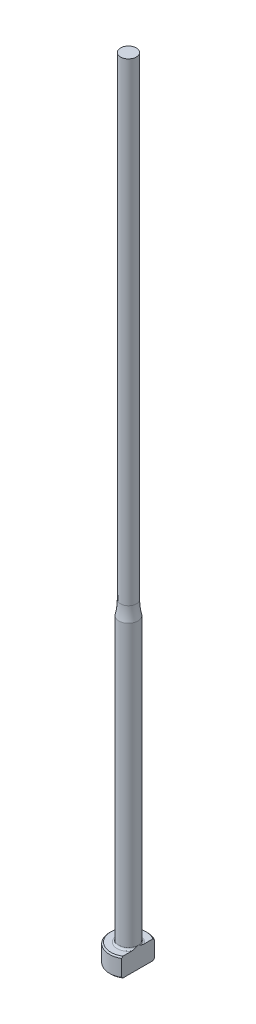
SolidWorks part; units mm, degrees
ref_plane "Front Plane" through (0, 0, 0) normal (0, 0, 1) x (1, 0, 0)
ref_plane "Top Plane" through (0, 0, 0) normal (0, 1, 0) x (1, 0, 0)
ref_plane "Right Plane" through (0, 0, 0) normal (1, 0, 0) x (0, 0, -1)
sketch "Sketch1" plane through (0, 0, 0) normal (0, 0, 1) x (1, 0, 0)
  line L0 (0, 259.9588) -> (0, -15.1925) construction
  line L1 (0, 0) -> (-3, 0)
  line L2 (-3, 0) -> (-3, 3)
  line L3 (-3, 3) -> (-1.5, 3)
  line L4 (-1.25, 50) -> (-1.25, 125)
  line L5 (-1.25, 125) -> (0, 125)
  line L6 (0, 125) -> (0, 0)
  line L7 (-1.5, 3) -> (-1.5, 47.778)
  arc A0 (-1.5, 47.778) -> (-1.25, 50) centre (-11.25, 50) ccw
  point P13 (-1.5, 0)
  dimension "D1" = 10
  dimension "L" = 125
  dimension "H" = 6
  dimension "T" = 3
  dimension "D" = 2.5
  dimension "B" = 3
  dimension "S" = 50
revolve "Revolve1" add sketch "Sketch1" angle 360 about L0
chamfer "Chamfer1" distance 0.2 angle 45 2 edges at (0, 3, 3) (0, 0, 3)
fillet "Fillet1" radius 0.3 1 edges at (0, 3, 1.5)
sketch "Sketch2" plane through (0, 0, 0) normal (0, 1, 0) x (1, 0, 0)
  line L0 (1.5, 2.5981) -> (1.5, -2.5981)
  circle A0 centre (0, 0) radius 3 construction
  arc A1 (1.5, -2.5981) -> (1.5, 2.5981) centre (0, 0) ccw
  circle A2 centre (0, 0) radius 1.5 construction
extrude "KEY" cut sketch "Sketch2" along normal through all
